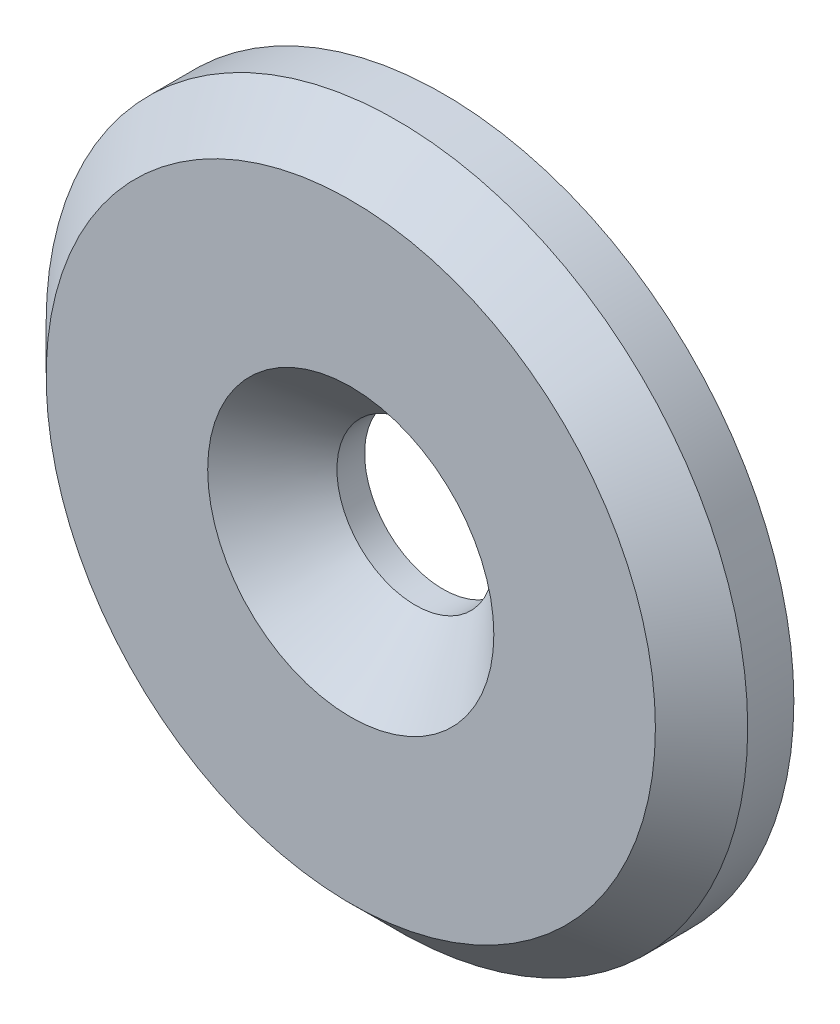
SolidWorks part; units mm, degrees
ref_plane "Plan1" through (0, 0, 0) normal (0, 0, 1) x (1, 0, 0)
ref_plane "Plan2" through (0, 0, 0) normal (0, 1, 0) x (1, 0, 0)
ref_plane "Plan3" through (0, 0, 0) normal (1, 0, 0) x (0, 0, -1)
sketch "Esquisse1" plane through (0, 0, 0) normal (0, 0, 1) x (1, 0, 0)
  circle A0 centre (0, 0) radius 19
  circle A1 centre (0, 0) radius 4.25
  dimension "D1" = 38
  dimension "D2" = 8.5
extrude "Base-Extrusion" add sketch "Esquisse1" along normal blind 5
chamfer "Chanfrein1" distance 2.5 angle 45
chamfer "Chanfrein2" distance 3.5 angle 45
